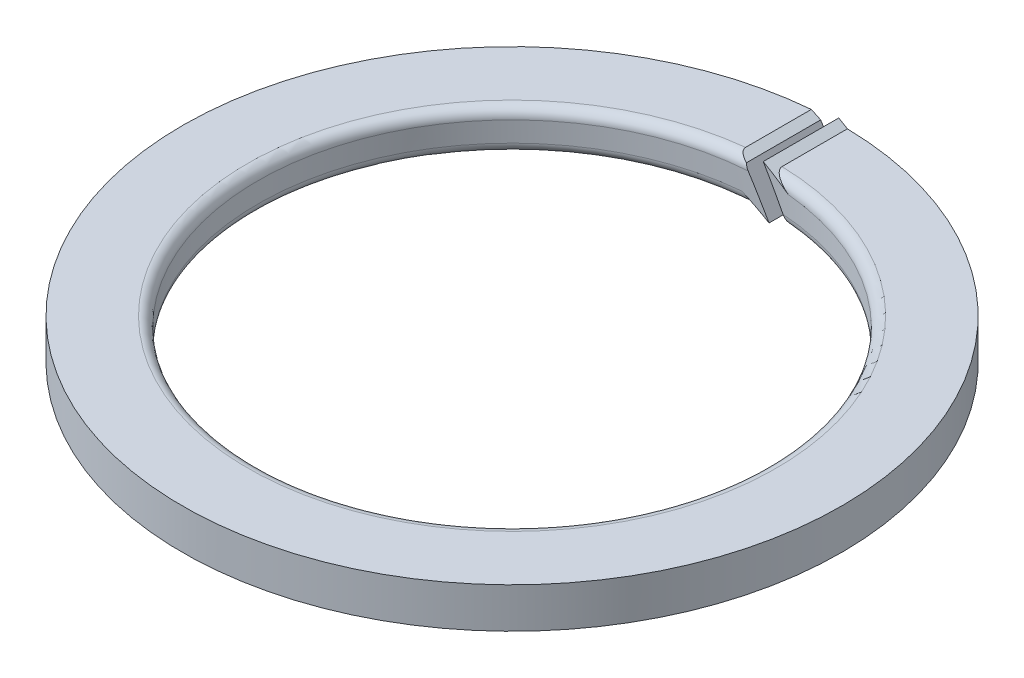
SolidWorks part; units mm, degrees
ref_plane "Front Plane" through (0, 0, 0) normal (0, 0, 1) x (1, 0, 0)
ref_plane "Top Plane" through (0, 0, 0) normal (0, 1, 0) x (1, 0, 0)
ref_plane "Right Plane" through (0, 0, 0) normal (1, 0, 0) x (0, 0, -1)
sketch "BodySke" plane through (0, 0, 0) normal (0, 0, 1) x (1, 0, 0)
  line L0 (0, 0) -> (0, 99.9596) construction
  line L1 (0, 0) -> (50.5, 0) construction
  line L3 (50.5, -10) -> (65.5, -10)
  line L4 (50.5, -10) -> (50.5, 10)
  line L5 (50.5, 10) -> (65.5, 10)
  line L6 (65.5, -10) -> (65.5, 10)
  line L7 (50.5, -4) -> (65.5, -4) construction
  line L8 (50.5, -4) -> (50.5, 4) construction
  line L9 (50.5, 4) -> (65.5, 4) construction
  line L10 (65.5, -4) -> (65.5, 4) construction
  dimension "Inner_dia" = 101
  dimension "Outer_dia" = 131
  dimension "D3" = 20
  dimension "Thickness" = 8
revolve "BaseBody" add sketch "BodySke" angle 360 about L0
sketch "Cut-ExtraSke" plane through (0, 0, 0) normal (0, 0, 1) x (1, 0, 0)
  line L1 (65.5, -4) -> (-65.5, -4)
  line L2 (65.5, -4) -> (65.5, -10)
  line L3 (65.5, -10) -> (-65.5, -10)
  line L4 (-65.5, -4) -> (-65.5, -10)
  line L5 (65.5, 4) -> (-65.5, 4)
  line L6 (65.5, 4) -> (65.5, 10)
  line L7 (65.5, 10) -> (-65.5, 10)
  line L8 (-65.5, 4) -> (-65.5, 10)
extrude "Cut-Extra" cut sketch "Cut-ExtraSke" along normal through all
sketch "ASke" plane through (0, 0, 0) normal (0, 0, 1) x (1, 0, 0)
  line L0 (0, -16.7192) -> (0, 28.802) construction
  line L1 (65.5, 4) -> (-65.5, 4) construction
  line L2 (0.5774, -5) -> (-4.6188, 4) construction
  line L4 (0.5774, -5) -> (-1.1547, -4)
  line L7 (-5.7735, 4) -> (-4.0415, 3)
  line L8 (-0.5774, 5) -> (4.6188, -4) construction
  line L9 (4.0415, -3) -> (5.7735, -4)
  line L10 (-65.5, 10) -> (65.5, 10)
  line L11 (-0.5774, 5) -> (1.1547, 4)
  line L12 (65.5, -4) -> (-65.5, -4) construction
  line L13 (65.5, 10) -> (65.5, 4)
  line L14 (65.5, 4) -> (1.1547, 4)
  line L15 (5.7735, -4) -> (65.5, -4)
  line L16 (65.5, -4) -> (65.5, -10)
  line L17 (65.5, -10) -> (-65.5, -10)
  line L18 (-65.5, -10) -> (-65.5, -4)
  line L19 (-65.5, -4) -> (-1.1547, -4)
  line L20 (0.5774, -5) -> (-4.0415, 3)
  line L21 (4.0415, -3) -> (-0.5774, 5)
  line L22 (-5.7735, 4) -> (-65.5, 4)
  line L23 (-65.5, 4) -> (-65.5, 10)
  line L24 (-65.5, 10) -> (-65.5, 4) construction
  line L25 (-65.5, -4) -> (-65.5, -10) construction
  line L26 (50.5, 10) -> (65.5, 10) construction
  line L27 (50.5, -10) -> (65.5, -10) construction
  point P11 (0, -4)
  point P12 (0, 4)
  dimension "Angle" = 30
  dimension "Side_angle" = 60
  dimension "Offset" = 1
  dimension "D4" = 1
  dimension "D5" = 1
  dimension "D6" = 1
extrude "Type-A" cut sketch "ASke" against normal through all
sketch "BSke" plane through (0, 0, 0) normal (0, 0, 1) x (1, 0, 0)
  line L0 (0, 0) -> (0, 31.0126) construction
  line L1 (0, 0) -> (0, 99.9596) construction
  line L2 (0, -4) -> (-4.6188, 4)
  line L3 (65.5, 4) -> (-65.5, 4) construction
  line L4 (0, 4) -> (4.6188, -4)
  line L5 (-65.5, -4) -> (65.5, -4) construction
  line L6 (-50.5, -4) -> (50.5, -4) construction
  line L7 (0, -4) -> (-65.5, -4)
  line L8 (-65.5, -4) -> (-65.5, -10)
  line L9 (-65.5, -10) -> (65.5, -10)
  line L10 (65.5, -10) -> (65.5, -4)
  line L11 (65.5, -4) -> (4.6188, -4)
  line L12 (0, 4) -> (65.5, 4)
  line L13 (65.5, 4) -> (65.5, 10)
  line L14 (65.5, 10) -> (-65.5, 10)
  line L15 (-65.5, 10) -> (-65.5, 4)
  line L16 (-65.5, 4) -> (-4.6188, 4)
  line L17 (-65.5, 4) -> (-65.5, -4) construction
  dimension "Angle" = 30
extrude "Type-B" [suppressed] cut sketch "BSke" against normal through all
fillet "Fillet1" radius 2 2 edges at (-2.3149, -4, 50.4469) (2.3149, 4, 50.4469)
equation "\"D4@ASke\" = \"Offset@ASke\""
equation "\"D5@ASke\" = \"Offset@ASke\""
equation "\"D6@ASke\" = \"Offset@ASke\""
